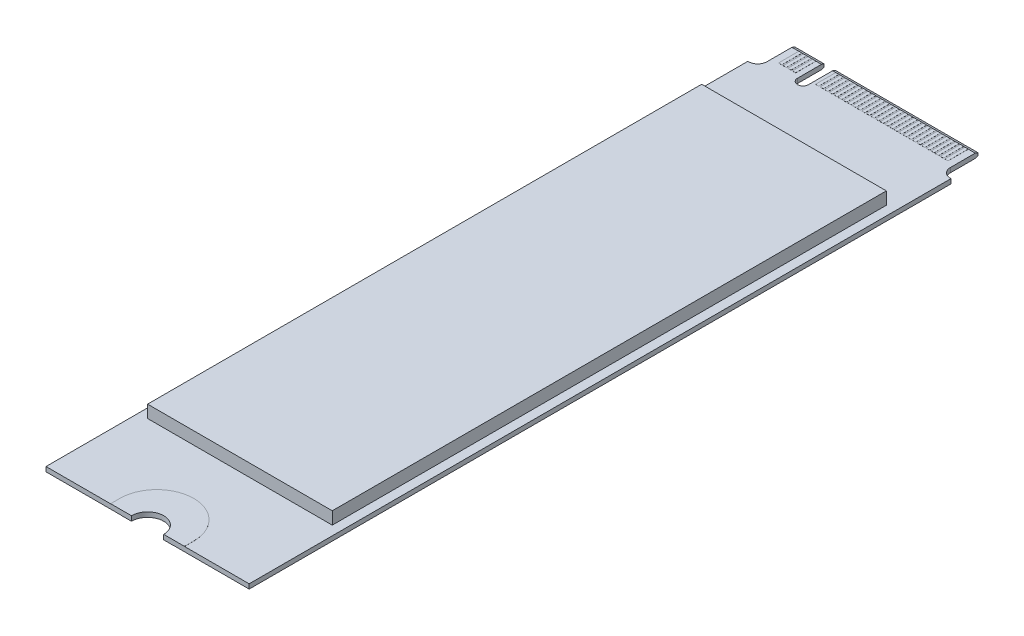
SolidWorks part; units mm, degrees
ref_plane "Front" through (0, 0, 0) normal (0, 0, 1) x (1, 0, 0)
ref_plane "Top" through (0, 0, 0) normal (0, 1, 0) x (1, 0, 0)
ref_plane "Right" through (0, 0, 0) normal (1, 0, 0) x (0, 0, -1)
sketch "Sketch1" plane through (0, 0, 0) normal (0, 1, 0) x (1, 0, 0)
  line L0 (0, 0) -> (0, 65.3465) construction
  line L1 (1.75, -40) -> (11, -40)
  line L2 (0, 40) -> (-5.525, 40)
  line L3 (-11, 36) -> (-11, -40)
  line L4 (-11, -40) -> (-1.75, -40)
  line L5 (11, 36) -> (11, -40)
  line L6 (-11, 36) -> (-10.925, 36)
  line L7 (-9.925, 40) -> (-9.925, 37)
  line L8 (9.925, 40) -> (9.925, 37)
  line L9 (10.925, 36) -> (11, 36)
  line L10 (-5.525, 37.1) -> (-5.525, 40)
  line L11 (6.225, 40) -> (9.925, 40)
  line L12 (-6.725, 37.1) -> (-6.725, 40)
  line L13 (-9.925, 40) -> (-6.725, 40)
  line L14 (0, 40) -> (5.025, 40)
  line L16 (5.025, 37.1) -> (5.025, 40)
  line L17 (6.225, 37.1) -> (6.225, 40)
  arc A0 (1.75, -40) -> (-1.75, -40) centre (0, -40) ccw
  arc A1 (9.925, 37) -> (10.925, 36) centre (10.925, 37) ccw
  arc A2 (-9.925, 37) -> (-10.925, 36) centre (-10.925, 37) cw
  arc A3 (-6.725, 37.1) -> (-5.525, 37.1) centre (-6.125, 37.1) ccw
  arc A4 (5.025, 37.1) -> (6.225, 37.1) centre (5.625, 37.1) ccw
  point P3 (-11, 40)
  point P6 (11, 40)
  point P18 (9.925, 36)
  dimension "D2" = 1
  dimension "D1" = 11
  dimension "D3" = 40
  dimension "D4" = 22
extrude "Boss-Extrude1" add sketch "Sketch1" against normal blind 0.5
sketch "Sketch5" plane through (9.925, 0, 0) normal (1, 0, 0) x (0, 0, -1)
  line L0 (40, 0) -> (39.7, 0)
  line L1 (37, 0) -> (40, 0) construction
  line L2 (40, 0) -> (40, -0.1092)
  line L3 (40, -0.1092) -> (39.7, 0)
  line L4 (40, -0.25) -> (38.9715, -0.25) construction
  line L5 (40, -0.5) -> (40, 0) construction
  line L6 (40, -0.3908) -> (39.7, -0.5)
  line L7 (40, -0.5) -> (40, -0.3908)
  line L8 (40, -0.5) -> (39.7, -0.5)
  dimension "D1" = 20
extrude "Cut-Extrude2" cut sketch "Sketch5" against normal through all
sketch "Sketch7" plane through (0, 0, 0) normal (0, 1, 0) x (1, 0, 0)
  line L1 (-10, 30) -> (10, 30)
  line L2 (-10, 30) -> (-10, -30)
  line L3 (-10, -30) -> (10, -30)
  line L4 (10, 30) -> (10, -30)
  arc A0 (1.75, -40) -> (-1.75, -40) centre (0, -40) ccw construction
  point P7 (0, -38.25)
  dimension "D1" = 60
  dimension "D2" = 20
  dimension "D3" = 10
  dimension "D4" = 30
extrude "Boss-Extrude3" add sketch "Sketch7" along normal blind 1.35
sketch "Sketch8" [suppressed] plane through (0, -0.5, 0) normal (0, -1, 0) x (1, 0, 0)
  line L1 (-10, 30) -> (10, 30)
  line L2 (-10, 30) -> (-10, -30)
  line L3 (-10, -30) -> (10, -30)
  line L4 (10, 30) -> (10, -30)
extrude "Boss-Extrude4" [suppressed] add sketch "Sketch8" along normal blind 1.35
sketch "Sketch12" plane through (0, -0.5, 0) normal (0, -1, 0) x (1, 0, 0)
  line L0 (-2.75, 40) -> (-1.75, 40)
  line L1 (1.75, 40) -> (2.75, 40)
  arc A1 (-1.75, 40) -> (1.75, 40) centre (0, 40) ccw construction
  arc A4 (-1.75, 40) -> (1.75, 40) centre (0, 40) ccw
  arc A5 (-2.75, 40) -> (2.75, 40) centre (0, 40) ccw
  dimension "D2" = 5.5
extrude "Boss-Extrude6" add sketch "Sketch12" along normal blind 0.01
ref_plane "Plane2" through (0, -0.25, 0) normal (0, 1, 0) x (1, 0, 0)
sketch "Sketch15" plane through (0, 0, 0) normal (0, 1, 0) x (1, 0, 0)
  line L0 (-4, -40) -> (-4, -39)
  line L1 (4, -40) -> (4, -39)
  line L2 (-4, -40) -> (-1.75, -40)
  line L3 (1.75, -40) -> (4, -40)
  arc A0 (1.75, -40) -> (-1.75, -40) centre (0, -40) ccw construction
  arc A1 (1.75, -40) -> (-1.75, -40) centre (0, -40) ccw
  arc A2 (4, -39) -> (-4, -39) centre (0, -39) ccw
extrude "Boss-Extrude9" add sketch "Sketch15" along normal blind 0.01
sketch "Sketch16" plane through (6.225, 0, 0) normal (-1, 0, 0) x (0, 0, 1)
  line L0 (-39.7, -0.5) -> (-40, -0.3908) construction
  line L1 (-40, -0.3908) -> (-40, -0.1092) construction
  line L2 (-40, -0.1092) -> (-39.7, 0) construction
  line L3 (-39.7, 0) -> (-37.1, 0) construction
  line L4 (-37.1, -0.5) -> (-37.1, 0) construction
  line L5 (-39.7, -0.5) -> (-37.1, -0.5) construction
  line L6 (-39.7, -0.5) -> (-40, -0.3908)
  line L7 (-40, -0.3908) -> (-40, -0.1092)
  line L8 (-40, -0.1092) -> (-39.7, 0)
  line L9 (-39.7, 0) -> (-37.1, 0)
  line L10 (-37.1, -0.5) -> (-37.1, 0)
  line L11 (-39.7, -0.5) -> (-37.1, -0.5)
extrude "Boss-Extrude10" add sketch "Sketch16" along normal up to next
sketch "Sketch17" plane through (0, -0.5, 0) normal (0, -1, 0) x (1, 0, 0)
  line L0 (5.025, -37.1) -> (6.225, -37.1) construction
  line L1 (5.025, -37.1) -> (6.225, -37.1)
  arc A0 (6.225, -37.1) -> (5.025, -37.1) centre (5.625, -37.1) ccw construction
  arc A1 (6.225, -37.1) -> (5.025, -37.1) centre (5.625, -37.1) ccw
extrude "Boss-Extrude11" add sketch "Sketch17" against normal up to surface (0.5 mm away)
sketch "Sketch18" plane through (0, -0.5, 0) normal (0, -1, 0) x (1, 0, 0)
  line L0 (0, 0) -> (0, -40) construction
  line L1 (-5.525, -40) -> (9.925, -40) construction
  line L3 (-9.4173, -38) -> (-9.0701, -38)
  line L4 (-8.9173, -38) -> (-8.5701, -38)
  line L5 (-8.9173, -38) -> (-8.9173, -39.7)
  line L6 (-9.925, -39.7) -> (-6.725, -39.7) construction
  line L7 (-9.4173, -38) -> (-9.4173, -39.7)
  line L8 (-9.0701, -38) -> (-9.0701, -39.7)
  line L9 (-9.0701, -39.7) -> (-9.4173, -39.7)
  line L10 (-8.5701, -38) -> (-8.5701, -39.7)
  line L11 (-8.5701, -39.7) -> (-8.9173, -39.7)
  line L12 (-8.4173, -38) -> (-8.0701, -38)
  line L13 (-8.4173, -38) -> (-8.4173, -39.7)
  line L14 (-8.0701, -38) -> (-8.0701, -39.7)
  line L15 (-8.0701, -39.7) -> (-8.4173, -39.7)
  line L16 (-7.9173, -38) -> (-7.5701, -38)
  line L17 (-7.9173, -38) -> (-7.9173, -39.7)
  line L18 (-7.5701, -38) -> (-7.5701, -39.7)
  line L19 (-7.5701, -39.7) -> (-7.9173, -39.7)
  line L20 (-7.4173, -38) -> (-7.0701, -38)
  line L21 (-7.4173, -38) -> (-7.4173, -39.7)
  line L22 (-7.0701, -38) -> (-7.0701, -39.7)
  line L23 (-7.0701, -39.7) -> (-7.4173, -39.7)
extrude "Boss-Extrude12" add sketch "Sketch18" along normal blind 0.01
sketch "Sketch19" plane through (0, -0.5, 0) normal (0, -1, 0) x (1, 0, 0)
  line L0 (0, 0) -> (0, -39.7) construction
  line L1 (-5.525, -39.7) -> (9.925, -39.7) construction
  line L3 (9.075, -38) -> (9.425, -38)
  line L4 (9.075, -39.7) -> (9.425, -39.7)
  line L5 (8.575, -38) -> (8.925, -38)
  line L6 (9.075, -38) -> (9.075, -39.7)
  line L7 (9.425, -38) -> (9.425, -39.7)
  line L8 (8.575, -39.7) -> (8.925, -39.7)
  line L9 (8.575, -38) -> (8.575, -39.7)
  line L10 (8.925, -38) -> (8.925, -39.7)
  line L11 (8.075, -38) -> (8.425, -38)
  line L12 (8.075, -39.7) -> (8.425, -39.7)
  line L13 (8.075, -38) -> (8.075, -39.7)
  line L14 (8.425, -38) -> (8.425, -39.7)
  line L15 (7.575, -38) -> (7.925, -38)
  line L16 (7.575, -39.7) -> (7.925, -39.7)
  line L17 (7.575, -38) -> (7.575, -39.7)
  line L18 (7.925, -38) -> (7.925, -39.7)
  line L19 (7.075, -38) -> (7.425, -38)
  line L20 (7.075, -39.7) -> (7.425, -39.7)
  line L21 (7.075, -38) -> (7.075, -39.7)
  line L22 (7.425, -38) -> (7.425, -39.7)
  line L23 (6.575, -38) -> (6.925, -38)
  line L24 (6.575, -39.7) -> (6.925, -39.7)
  line L25 (6.575, -38) -> (6.575, -39.7)
  line L26 (6.925, -38) -> (6.925, -39.7)
  line L27 (6.075, -38) -> (6.425, -38)
  line L28 (6.075, -39.7) -> (6.425, -39.7)
  line L29 (6.075, -38) -> (6.075, -39.7)
  line L30 (6.425, -38) -> (6.425, -39.7)
  line L31 (5.575, -38) -> (5.925, -38)
  line L32 (5.575, -39.7) -> (5.925, -39.7)
  line L33 (5.575, -38) -> (5.575, -39.7)
  line L34 (5.925, -38) -> (5.925, -39.7)
  line L35 (5.075, -38) -> (5.425, -38)
  line L36 (5.075, -39.7) -> (5.425, -39.7)
  line L37 (5.075, -38) -> (5.075, -39.7)
  line L38 (5.425, -38) -> (5.425, -39.7)
  line L39 (4.575, -38) -> (4.925, -38)
  line L40 (4.575, -39.7) -> (4.925, -39.7)
  line L41 (4.575, -38) -> (4.575, -39.7)
  line L42 (4.925, -38) -> (4.925, -39.7)
  line L43 (4.075, -38) -> (4.425, -38)
  line L44 (4.075, -39.7) -> (4.425, -39.7)
  line L45 (4.075, -38) -> (4.075, -39.7)
  line L46 (4.425, -38) -> (4.425, -39.7)
  line L47 (3.575, -38) -> (3.925, -38)
  line L48 (3.575, -39.7) -> (3.925, -39.7)
  line L49 (3.575, -38) -> (3.575, -39.7)
  line L50 (3.925, -38) -> (3.925, -39.7)
  line L51 (3.075, -38) -> (3.425, -38)
  line L52 (3.075, -39.7) -> (3.425, -39.7)
  line L53 (3.075, -38) -> (3.075, -39.7)
  line L54 (3.425, -38) -> (3.425, -39.7)
  line L55 (2.575, -38) -> (2.925, -38)
  line L56 (2.575, -39.7) -> (2.925, -39.7)
  line L57 (2.575, -38) -> (2.575, -39.7)
  line L58 (2.925, -38) -> (2.925, -39.7)
  line L59 (2.075, -38) -> (2.425, -38)
  line L60 (2.075, -39.7) -> (2.425, -39.7)
  line L61 (2.075, -38) -> (2.075, -39.7)
  line L62 (2.425, -38) -> (2.425, -39.7)
  line L63 (1.575, -38) -> (1.925, -38)
  line L64 (1.575, -39.7) -> (1.925, -39.7)
  line L65 (1.575, -38) -> (1.575, -39.7)
  line L66 (1.925, -38) -> (1.925, -39.7)
  line L67 (1.075, -38) -> (1.425, -38)
  line L68 (1.075, -39.7) -> (1.425, -39.7)
  line L69 (1.075, -38) -> (1.075, -39.7)
  line L70 (1.425, -38) -> (1.425, -39.7)
  line L71 (0.575, -38) -> (0.925, -38)
  line L72 (0.575, -39.7) -> (0.925, -39.7)
  line L73 (0.575, -38) -> (0.575, -39.7)
  line L74 (0.925, -38) -> (0.925, -39.7)
  line L75 (0.075, -38) -> (0.425, -38)
  line L76 (0.075, -39.7) -> (0.425, -39.7)
  line L77 (0.075, -38) -> (0.075, -39.7)
  line L78 (0.425, -38) -> (0.425, -39.7)
  line L79 (-0.425, -38) -> (-0.075, -38)
  line L80 (-0.425, -39.7) -> (-0.075, -39.7)
  line L81 (-0.425, -38) -> (-0.425, -39.7)
  line L82 (-0.075, -38) -> (-0.075, -39.7)
  line L83 (-0.925, -38) -> (-0.575, -38)
  line L84 (-0.925, -39.7) -> (-0.575, -39.7)
  line L85 (-0.925, -38) -> (-0.925, -39.7)
  line L86 (-0.575, -38) -> (-0.575, -39.7)
  line L87 (-1.425, -38) -> (-1.075, -38)
  line L88 (-1.425, -39.7) -> (-1.075, -39.7)
  line L89 (-1.425, -38) -> (-1.425, -39.7)
  line L90 (-1.075, -38) -> (-1.075, -39.7)
  line L91 (-1.925, -38) -> (-1.575, -38)
  line L92 (-1.925, -39.7) -> (-1.575, -39.7)
  line L93 (-1.925, -38) -> (-1.925, -39.7)
  line L94 (-1.575, -38) -> (-1.575, -39.7)
  line L95 (-2.425, -38) -> (-2.075, -38)
  line L96 (-2.425, -39.7) -> (-2.075, -39.7)
  line L97 (-2.425, -38) -> (-2.425, -39.7)
  line L98 (-2.075, -38) -> (-2.075, -39.7)
  line L99 (-2.925, -38) -> (-2.575, -38)
  line L100 (-2.925, -39.7) -> (-2.575, -39.7)
  line L101 (-2.925, -38) -> (-2.925, -39.7)
  line L102 (-2.575, -38) -> (-2.575, -39.7)
  line L103 (-3.425, -38) -> (-3.075, -38)
  line L104 (-3.425, -39.7) -> (-3.075, -39.7)
  line L105 (-3.425, -38) -> (-3.425, -39.7)
  line L106 (-3.075, -38) -> (-3.075, -39.7)
  line L107 (-3.925, -38) -> (-3.575, -38)
  line L108 (-3.925, -39.7) -> (-3.575, -39.7)
  line L109 (-3.925, -38) -> (-3.925, -39.7)
  line L110 (-3.575, -38) -> (-3.575, -39.7)
  line L111 (-4.425, -38) -> (-4.075, -38)
  line L112 (-4.425, -39.7) -> (-4.075, -39.7)
  line L113 (-4.425, -38) -> (-4.425, -39.7)
  line L114 (-4.075, -38) -> (-4.075, -39.7)
  line L115 (-4.925, -38) -> (-4.575, -38)
  line L116 (-4.925, -39.7) -> (-4.575, -39.7)
  line L117 (-4.925, -38) -> (-4.925, -39.7)
  line L118 (-4.575, -38) -> (-4.575, -39.7)
extrude "Boss-Extrude13" add sketch "Sketch19" along normal blind 0.01
sketch "Sketch21" plane through (0, 0, 0) normal (0, 1, 0) x (1, 0, 0)
  line L0 (8.3278, 39.7) -> (8.6778, 39.7)
  line L1 (9.003, 35.183) -> (9.0027, 38.073) construction
  line L2 (8.3278, 37.5) -> (8.3278, 39.7)
  line L3 (8.6778, 39.7) -> (8.6778, 37.5)
  line L4 (8.928, 35.183) -> (9.078, 35.183) construction
  line L5 (8.9277, 38.073) -> (9.0777, 38.073) construction
  line L6 (8.5027, 38.0729) -> (8.503, 35.1829) construction
  line L7 (8.4277, 38.0729) -> (8.5777, 38.0729) construction
  line L8 (8.428, 35.1829) -> (8.578, 35.1829) construction
  line L12 (8.8278, 39.7) -> (9.1778, 39.7)
  line L13 (8.8278, 37.5) -> (8.8278, 39.7)
  line L14 (9.1778, 39.7) -> (9.1778, 37.5)
  line L15 (8.8278, 37.5) -> (9.1778, 37.5)
  line L16 (8.3278, 37.5) -> (8.6778, 37.5)
  line L17 (7.8278, 39.7) -> (8.1778, 39.7)
  line L18 (7.8278, 37.5) -> (7.8278, 39.7)
  line L19 (8.1778, 39.7) -> (8.1778, 37.5)
  line L20 (7.8278, 37.5) -> (8.1778, 37.5)
  line L21 (7.3278, 39.7) -> (7.6778, 39.7)
  line L22 (7.3278, 37.5) -> (7.3278, 39.7)
  line L23 (7.6778, 39.7) -> (7.6778, 37.5)
  line L24 (7.3278, 37.5) -> (7.6778, 37.5)
  line L25 (6.8278, 39.7) -> (7.1778, 39.7)
  line L26 (6.8278, 37.5) -> (6.8278, 39.7)
  line L27 (7.1778, 39.7) -> (7.1778, 37.5)
  line L28 (6.8278, 37.5) -> (7.1778, 37.5)
  line L29 (6.3278, 39.7) -> (6.6778, 39.7)
  line L30 (6.3278, 37.5) -> (6.3278, 39.7)
  line L31 (6.6778, 39.7) -> (6.6778, 37.5)
  line L32 (6.3278, 37.5) -> (6.6778, 37.5)
  line L33 (5.8278, 39.7) -> (6.1778, 39.7)
  line L34 (5.8278, 37.5) -> (5.8278, 39.7)
  line L35 (6.1778, 39.7) -> (6.1778, 37.5)
  line L36 (5.8278, 37.5) -> (6.1778, 37.5)
  line L37 (5.3278, 39.7) -> (5.6778, 39.7)
  line L38 (5.3278, 37.5) -> (5.3278, 39.7)
  line L39 (5.6778, 39.7) -> (5.6778, 37.5)
  line L40 (5.3278, 37.5) -> (5.6778, 37.5)
  line L41 (4.8278, 39.7) -> (5.1778, 39.7)
  line L42 (4.8278, 37.5) -> (4.8278, 39.7)
  line L43 (5.1778, 39.7) -> (5.1778, 37.5)
  line L44 (4.8278, 37.5) -> (5.1778, 37.5)
  line L45 (4.3278, 39.7) -> (4.6778, 39.7)
  line L46 (4.3278, 37.5) -> (4.3278, 39.7)
  line L47 (4.6778, 39.7) -> (4.6778, 37.5)
  line L48 (4.3278, 37.5) -> (4.6778, 37.5)
  line L49 (3.8278, 39.7) -> (4.1778, 39.7)
  line L50 (3.8278, 37.5) -> (3.8278, 39.7)
  line L51 (4.1778, 39.7) -> (4.1778, 37.5)
  line L52 (3.8278, 37.5) -> (4.1778, 37.5)
  line L53 (3.3278, 39.7) -> (3.6778, 39.7)
  line L54 (3.3278, 37.5) -> (3.3278, 39.7)
  line L55 (3.6778, 39.7) -> (3.6778, 37.5)
  line L56 (3.3278, 37.5) -> (3.6778, 37.5)
  line L57 (2.8278, 39.7) -> (3.1778, 39.7)
  line L58 (2.8278, 37.5) -> (2.8278, 39.7)
  line L59 (3.1778, 39.7) -> (3.1778, 37.5)
  line L60 (2.8278, 37.5) -> (3.1778, 37.5)
  line L61 (2.3278, 39.7) -> (2.6778, 39.7)
  line L62 (2.3278, 37.5) -> (2.3278, 39.7)
  line L63 (2.6778, 39.7) -> (2.6778, 37.5)
  line L64 (2.3278, 37.5) -> (2.6778, 37.5)
  line L65 (1.8278, 39.7) -> (2.1778, 39.7)
  line L66 (1.8278, 37.5) -> (1.8278, 39.7)
  line L67 (2.1778, 39.7) -> (2.1778, 37.5)
  line L68 (1.8278, 37.5) -> (2.1778, 37.5)
  line L69 (1.3278, 39.7) -> (1.6778, 39.7)
  line L70 (1.3278, 37.5) -> (1.3278, 39.7)
  line L71 (1.6778, 39.7) -> (1.6778, 37.5)
  line L72 (1.3278, 37.5) -> (1.6778, 37.5)
  line L73 (0.8278, 39.7) -> (1.1778, 39.7)
  line L74 (0.8278, 37.5) -> (0.8278, 39.7)
  line L75 (1.1778, 39.7) -> (1.1778, 37.5)
  line L76 (0.8278, 37.5) -> (1.1778, 37.5)
  line L77 (0.3278, 39.7) -> (0.6778, 39.7)
  line L78 (0.3278, 37.5) -> (0.3278, 39.7)
  line L79 (0.6778, 39.7) -> (0.6778, 37.5)
  line L80 (0.3278, 37.5) -> (0.6778, 37.5)
  line L81 (-0.1722, 39.7) -> (0.1778, 39.7)
  line L82 (-0.1722, 37.5) -> (-0.1722, 39.7)
  line L83 (0.1778, 39.7) -> (0.1778, 37.5)
  line L84 (-0.1722, 37.5) -> (0.1778, 37.5)
  line L85 (-0.6722, 39.7) -> (-0.3222, 39.7)
  line L86 (-0.6722, 37.5) -> (-0.6722, 39.7)
  line L87 (-0.3222, 39.7) -> (-0.3222, 37.5)
  line L88 (-0.6722, 37.5) -> (-0.3222, 37.5)
  line L89 (-1.1722, 39.7) -> (-0.8222, 39.7)
  line L90 (-1.1722, 37.5) -> (-1.1722, 39.7)
  line L91 (-0.8222, 39.7) -> (-0.8222, 37.5)
  line L92 (-1.1722, 37.5) -> (-0.8222, 37.5)
  line L93 (-1.6722, 39.7) -> (-1.3222, 39.7)
  line L94 (-1.6722, 37.5) -> (-1.6722, 39.7)
  line L95 (-1.3222, 39.7) -> (-1.3222, 37.5)
  line L96 (-1.6722, 37.5) -> (-1.3222, 37.5)
  line L97 (-2.1722, 39.7) -> (-1.8222, 39.7)
  line L98 (-2.1722, 37.5) -> (-2.1722, 39.7)
  line L99 (-1.8222, 39.7) -> (-1.8222, 37.5)
  line L100 (-2.1722, 37.5) -> (-1.8222, 37.5)
  line L101 (-2.6722, 39.7) -> (-2.3222, 39.7)
  line L102 (-2.6722, 37.5) -> (-2.6722, 39.7)
  line L103 (-2.3222, 39.7) -> (-2.3222, 37.5)
  line L104 (-2.6722, 37.5) -> (-2.3222, 37.5)
  line L105 (-3.1722, 39.7) -> (-2.8222, 39.7)
  line L106 (-3.1722, 37.5) -> (-3.1722, 39.7)
  line L107 (-2.8222, 39.7) -> (-2.8222, 37.5)
  line L108 (-3.1722, 37.5) -> (-2.8222, 37.5)
  line L109 (-3.6722, 39.7) -> (-3.3222, 39.7)
  line L110 (-3.6722, 37.5) -> (-3.6722, 39.7)
  line L111 (-3.3222, 39.7) -> (-3.3222, 37.5)
  line L112 (-3.6722, 37.5) -> (-3.3222, 37.5)
  line L113 (-4.1722, 39.7) -> (-3.8222, 39.7)
  line L114 (-4.1722, 37.5) -> (-4.1722, 39.7)
  line L115 (-3.8222, 39.7) -> (-3.8222, 37.5)
  line L116 (-4.1722, 37.5) -> (-3.8222, 37.5)
  line L117 (-4.6722, 39.7) -> (-4.3222, 39.7)
  line L118 (-4.6722, 37.5) -> (-4.6722, 39.7)
  line L119 (-4.3222, 39.7) -> (-4.3222, 37.5)
  line L120 (-4.6722, 37.5) -> (-4.3222, 37.5)
  line L121 (-5.1722, 39.7) -> (-4.8222, 39.7)
  line L122 (-5.1722, 37.5) -> (-5.1722, 39.7)
  line L123 (-4.8222, 39.7) -> (-4.8222, 37.5)
  line L124 (-5.1722, 37.5) -> (-4.8222, 37.5)
  line L125 (-5.6722, 39.7) -> (-5.3222, 39.7)
  line L126 (-5.6722, 37.5) -> (-5.6722, 39.7)
  line L127 (-5.3222, 39.7) -> (-5.3222, 37.5)
  line L128 (-5.6722, 37.5) -> (-5.3222, 37.5)
  line L129 (-6.1722, 39.7) -> (-5.8222, 39.7)
  line L130 (-6.1722, 37.5) -> (-6.1722, 39.7)
  line L131 (-5.8222, 39.7) -> (-5.8222, 37.5)
  line L132 (-6.1722, 37.5) -> (-5.8222, 37.5)
  line L133 (-6.6722, 39.7) -> (-6.3222, 39.7)
  line L134 (-6.6722, 37.5) -> (-6.6722, 39.7)
  line L135 (-6.3222, 39.7) -> (-6.3222, 37.5)
  line L136 (-6.6722, 37.5) -> (-6.3222, 37.5)
  line L141 (-7.6722, 39.7) -> (-7.3222, 39.7)
  line L142 (-7.6722, 37.5) -> (-7.6722, 39.7)
  line L143 (-7.3222, 39.7) -> (-7.3222, 37.5)
  line L144 (-7.6722, 37.5) -> (-7.3222, 37.5)
  line L145 (-8.1722, 39.7) -> (-7.8222, 39.7)
  line L146 (-8.1722, 37.5) -> (-8.1722, 39.7)
  line L147 (-7.8222, 39.7) -> (-7.8222, 37.5)
  line L148 (-8.1722, 37.5) -> (-7.8222, 37.5)
  line L149 (-8.6722, 39.7) -> (-8.3222, 39.7)
  line L150 (-8.6722, 37.5) -> (-8.6722, 39.7)
  line L151 (-8.3222, 39.7) -> (-8.3222, 37.5)
  line L152 (-8.6722, 37.5) -> (-8.3222, 37.5)
  line L153 (-9.1722, 39.7) -> (-8.8222, 39.7)
  line L154 (-9.1722, 37.5) -> (-9.1722, 39.7)
  line L155 (-8.8222, 39.7) -> (-8.8222, 37.5)
  line L156 (-9.1722, 37.5) -> (-8.8222, 37.5)
  line L161 (-7.1722, 37.5) -> (-6.8222, 37.5)
  line L162 (-6.8222, 39.7) -> (-6.8222, 37.5)
  line L163 (-7.1722, 37.5) -> (-7.1722, 39.7)
  line L164 (-7.1722, 39.7) -> (-6.8222, 39.7)
  line L165 (-9.6722, 37.5) -> (-9.6722, 39.7)
  line L166 (-9.6722, 37.5) -> (-9.3222, 37.5)
  line L167 (-9.3222, 39.7) -> (-9.3222, 37.5)
  line L168 (-9.6722, 39.7) -> (-9.3222, 39.7)
  dimension "D1" = 38
extrude "Boss-Extrude15" add sketch "Sketch21" along normal blind 0.01
